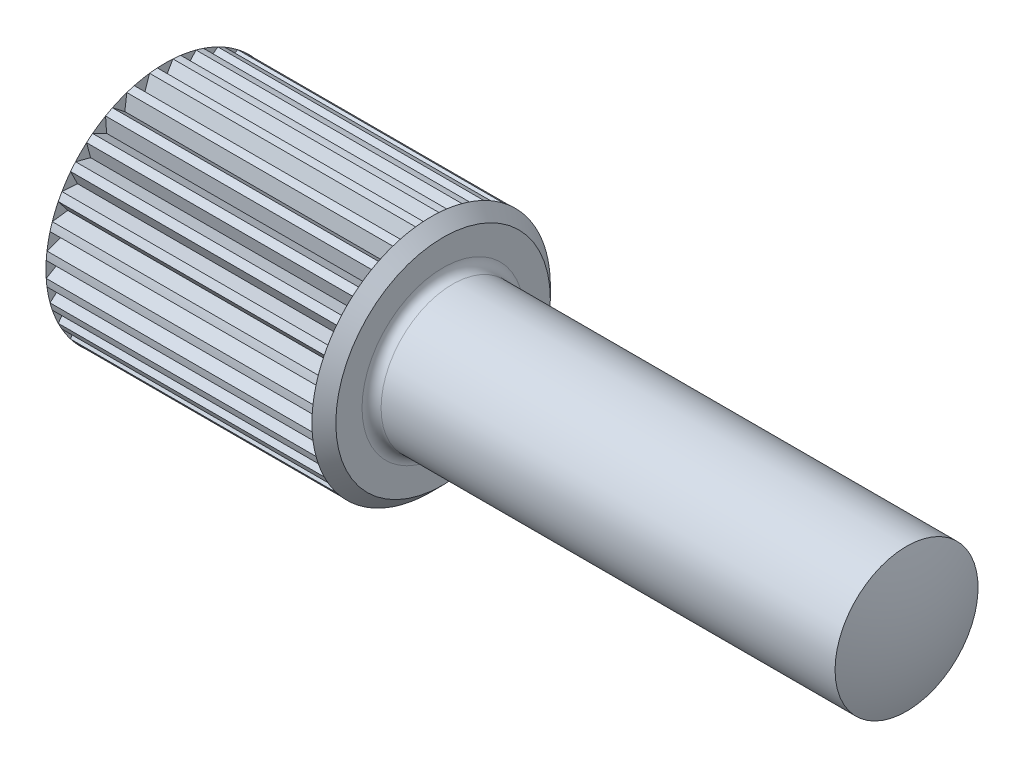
SolidWorks part; units mm, degrees
ref_plane "Front" through (0, 0, 0) normal (0, 0, 1) x (1, 0, 0)
ref_plane "Top" through (0, 0, 0) normal (0, 1, 0) x (1, 0, 0)
ref_plane "Right" through (0, 0, 0) normal (1, 0, 0) x (0, 0, -1)
sketch "Sketch1" plane through (0, 0, 0) normal (0, 0, 1) x (1, 0, 0)
  line L0 (0, 0) -> (33, 0)
  line L1 (1.3397, 5) -> (13, 5)
  line L2 (13, 5) -> (13, 3)
  line L7 (13, 3) -> (32.446, 3)
  line L9 (-48.2111, 0) -> (101.1311, 0) construction
  arc A0 (33, 0) -> (32.446, 3) centre (24.6, 0) ccw
  arc A1 (1.3397, 5) -> (0, 0) centre (10, 0) ccw
  dimension "re" = 8.4
  dimension "dr" = 10
  dimension "dk" = 10
  dimension "d" = 6
  dimension "k" = 13
  dimension "l" = 20
revolve "Base" add sketch "Sketch1" angle 360 about L9
chamfer "Chamfer1" distance 0.5 angle 45 1 edges at (13, 0, 5)
ref_plane "Plane1" through (1.3397, 0, 0) normal (1, 0, 0) x (0, 0, -1)
ref_plane "Plane2" through (12.5, 0, 0) normal (1, 0, 0) x (0, 0, -1)
sketch "Sketch2" plane through (1.3397, 0, 0) normal (1, 0, 0) x (0, 0, -1)
  line L1 (0, 4.4226) -> (0.5, 5.2887)
  line L2 (0.5, 5.2887) -> (-0.5, 5.2887)
  line L3 (-0.5, 5.2887) -> (0, 4.4226)
  circle A0 centre (0, 0) radius 5 construction
  circle A2 centre (0, 5) radius 0.2887 construction
  dimension "D1" = 1
extrude "Cut-Extrude1" cut sketch "Sketch2" along normal up to surface (11.1603 mm away)
pattern_circular "Circular-Pattern1" count 32 over 360 about axis through (0, 0, 0) along (1, 0, 0) of "Cut-Extrude1"
fillet "Fillet1" radius 0.4 1 edges at (13, 0, 3)
sketch "Sketch3" plane through (0, 0, 0) normal (0, 0, 1) x (1, 0, 0)
  line L0 (13.4, 3.75) -> (14.15, 3.75)
  line L1 (14.15, 3.75) -> (14.15, 3)
  line L2 (14.15, 3) -> (13.775, 2.3505)
  line L3 (13.775, 2.3505) -> (13.4, 3)
  line L4 (13.4, 3) -> (13.4, 3.75)
  line L5 (13.4, -3) -> (13.4, 3) construction
  line L6 (32.446, 3) -> (13.4, 3) construction
  dimension "D1" = 0.75
revolve "Cut-Revolve10" [suppressed] cut sketch "Sketch3" angle 360 about axis through (-48.2111, 0, 0) along (1, 0, 0)
pattern_linear "LPattern10" [suppressed] count 22 along (1, 0, 0)
equation "\"D1@Circular-Pattern1\" =int (  \"dk@Sketch1\" * PI+1 )"
equation "\"D1@Plane2\" = \"c@Chamfer1\""
equation "\"D1@Sketch3\" =  ( \"d@Sketch1\" - \"THD_MINOR@ThreadCosmetic1\" )  / 2"
equation "\"pitch@LPattern10\" = 1.2 * \"D1@Sketch3\""
equation "\"D1@LPattern10\" =  ( \"l@Sketch1\" - \"r@Fillet1\" )  / \"pitch@LPattern10\""
